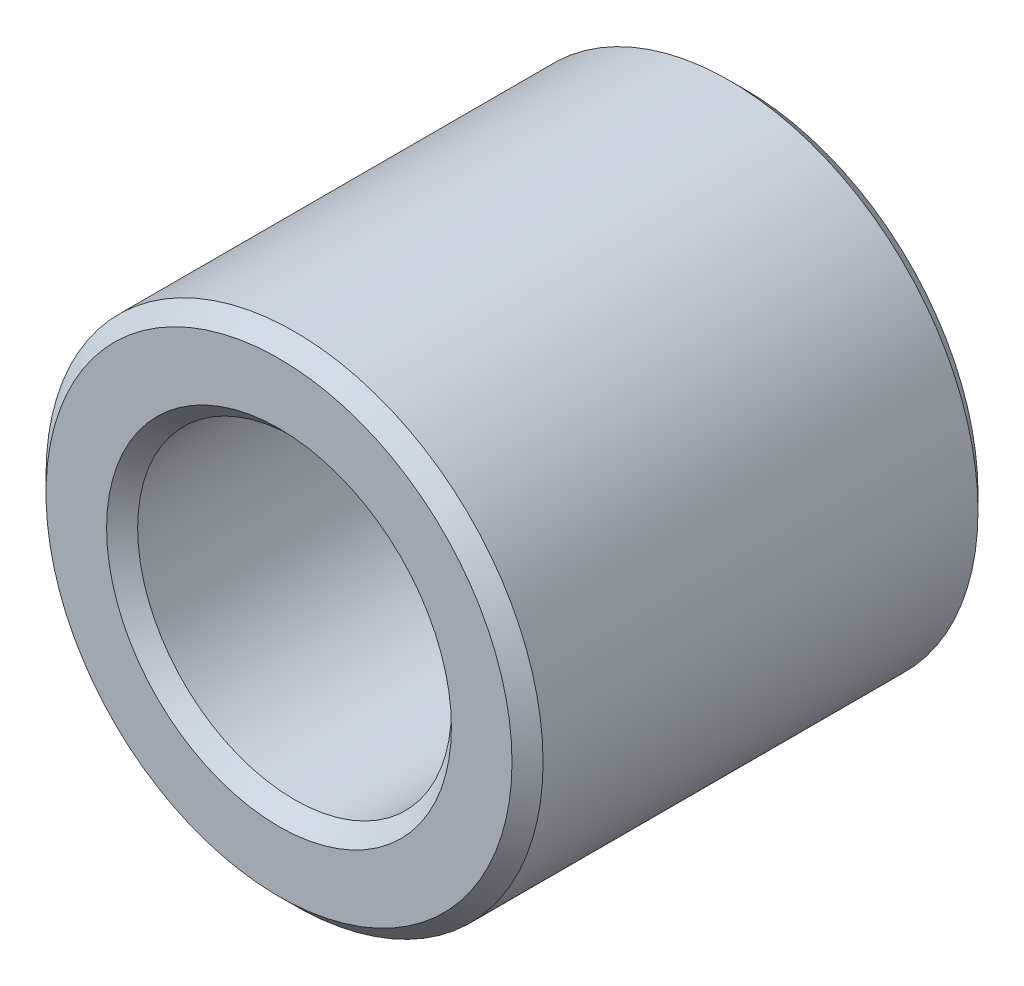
SolidWorks part; units mm, degrees
ref_plane "Plan de face" through (0, 0, 0) normal (0, 0, 1) x (1, 0, 0)
ref_plane "Plan de dessus" through (0, 0, 0) normal (0, 1, 0) x (1, 0, 0)
ref_plane "Plan de droite" through (0, 0, 0) normal (1, 0, 0) x (0, 0, -1)
sketch "Esquisse1" plane through (0, 0, 0) normal (0, 0, 1) x (1, 0, 0)
  circle A0 centre (0, 0) radius 8
  circle A1 centre (0, 0) radius 5.05
  dimension "D1" = 16
  dimension "D2" = 10.1
extrude "Boss.-Extru.1" add sketch "Esquisse1" along normal blind 15
chamfer "Chanfrein1" distance 0.5 angle 45 4 edges at (5.05, 0, 0) (8, 0, 0) (5.05, 0, 15) (8, 0, 15)
